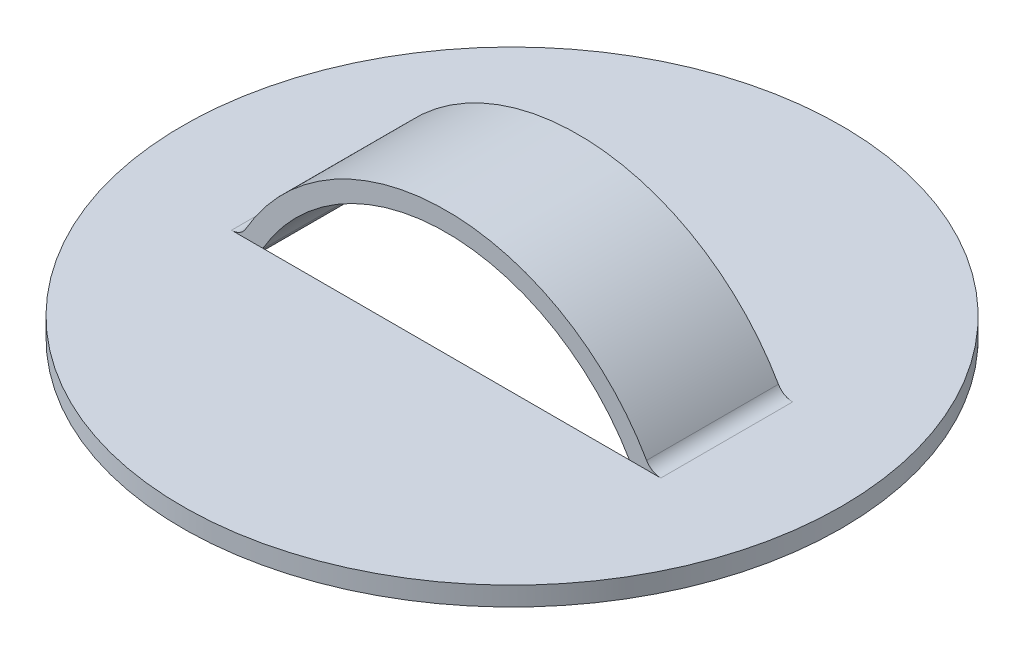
SolidWorks part; units mm, degrees
ref_plane "Front Plane" through (0, 0, 0) normal (0, 0, 1) x (1, 0, 0)
ref_plane "Top Plane" through (0, 0, 0) normal (0, 1, 0) x (1, 0, 0)
ref_plane "Right Plane" through (0, 0, 0) normal (1, 0, 0) x (0, 0, -1)
sketch "Sketch1" plane through (0, 0, 0) normal (0, 0, 1) x (1, 0, 0)
  line L0 (-15.875, 0) -> (-10.3385, 0)
  line L1 (0, 0) -> (0, -7.2881) construction
  line L2 (10.3385, 0) -> (15.875, 0)
  line L3 (-15.875, -0.9144) -> (-10.3385, -0.9144)
  line L4 (10.3385, -0.9144) -> (15.875, -0.9144)
  line L6 (-15.875, 0) -> (-15.875, -0.9144)
  line L7 (15.875, 0) -> (15.875, -0.9144)
  arc A0 (9.6552, 0.3962) -> (-9.6552, 0.3962) centre (0, -5.1308) ccw
  arc A1 (10.3385, 0) -> (9.6552, 0.3962) centre (10.3385, 0.7874) cw
  arc A2 (-10.3385, 0) -> (-9.6552, 0.3962) centre (-10.3385, 0.7874) ccw
  arc A3 (-10.3385, -0.9144) -> (-8.8616, -0.0581) centre (-10.3385, 0.7874) ccw
  arc A4 (8.8616, -0.0581) -> (-8.8616, -0.0581) centre (0, -5.1308) ccw
  arc A5 (10.3385, -0.9144) -> (8.8616, -0.0581) centre (10.3385, 0.7874) cw
  dimension "D2" = 22.2504
  dimension "D4" = 0.7874
  dimension "D1" = 31.75
  dimension "D3" = 5.9944
  dimension "D5" = 0.9144
extrude "Boss-Extrude1" add sketch "Sketch1" along normal blind 6.35
sketch "Sketch2" plane through (0, -0.9144, 0) normal (0, -1, 0) x (1, 0, 0)
  line L0 (0, 6.35) -> (0, 0) construction
  line L1 (-10.3385, 6.35) -> (10.3385, 6.35)
  line L2 (-10.3385, 6.35) -> (-10.3385, 0)
  line L3 (-10.3385, 0) -> (10.3385, 0)
  line L4 (10.3385, 6.35) -> (10.3385, 0)
  circle A0 centre (0, 3.175) radius 15.875
extrude "Boss-Extrude3" add sketch "Sketch2" against normal up to vertex
other "DeleteFace1"
